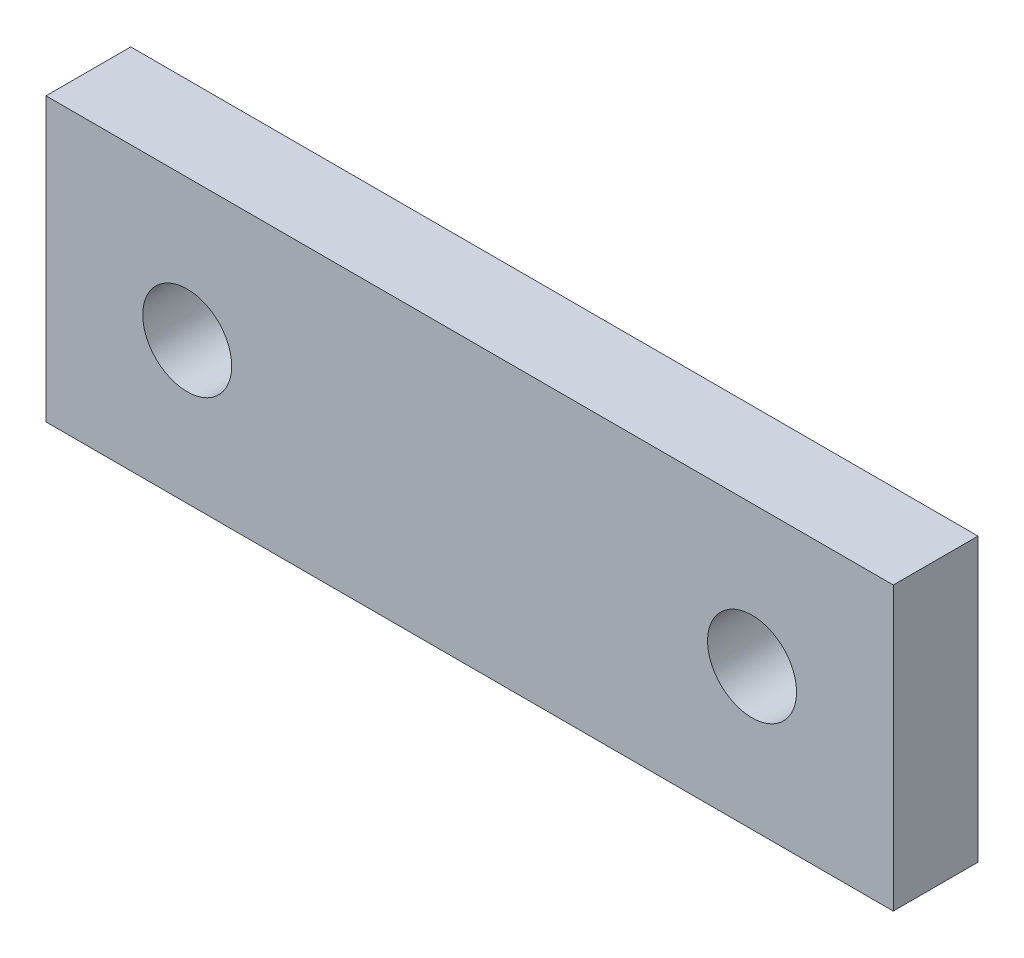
SolidWorks part; units mm, degrees
ref_plane "Front Plane" through (0, 0, 0) normal (0, 0, 1) x (1, 0, 0)
ref_plane "Top Plane" through (0, 0, 0) normal (0, 1, 0) x (1, 0, 0)
ref_plane "Right Plane" through (0, 0, 0) normal (1, 0, 0) x (0, 0, -1)
sketch "Sketch1" plane through (0, 0, 0) normal (0, 0, 1) x (1, 0, 0)
  line L1 (-38.1, -12.7) -> (38.1, -12.7)
  line L2 (-38.1, -12.7) -> (-38.1, 12.7)
  line L3 (-38.1, 12.7) -> (38.1, 12.7)
  line L4 (38.1, -12.7) -> (38.1, 12.7)
  line L5 (-38.1, -12.7) -> (38.1, 12.7) construction
  line L6 (-38.1, 12.7) -> (38.1, -12.7) construction
  point P0 (0, 0)
  dimension "D1" = 76.2
  dimension "D2" = 25.4
extrude "Boss-Extrude1" add sketch "Sketch1" along normal blind 7.62
sketch "Sketch2" plane through (0, 0, 7.62) normal (0, 0, 1) x (1, 0, 0)
  line L0 (-38.1, 0) -> (38.1, 0) construction
  line L1 (-38.1, 12.7) -> (-38.1, -12.7) construction
  line L2 (38.1, -12.7) -> (38.1, 12.7) construction
  circle A0 centre (-25.4, 0) radius 4
  dimension "D1" = 8
  dimension "D2" = 12.7
extrude "Cut-Extrude1" cut sketch "Sketch2" against normal through all
mirror "Mirror1" about plane through (0, 0, 0) normal (1, 0, 0) of "Cut-Extrude1"
